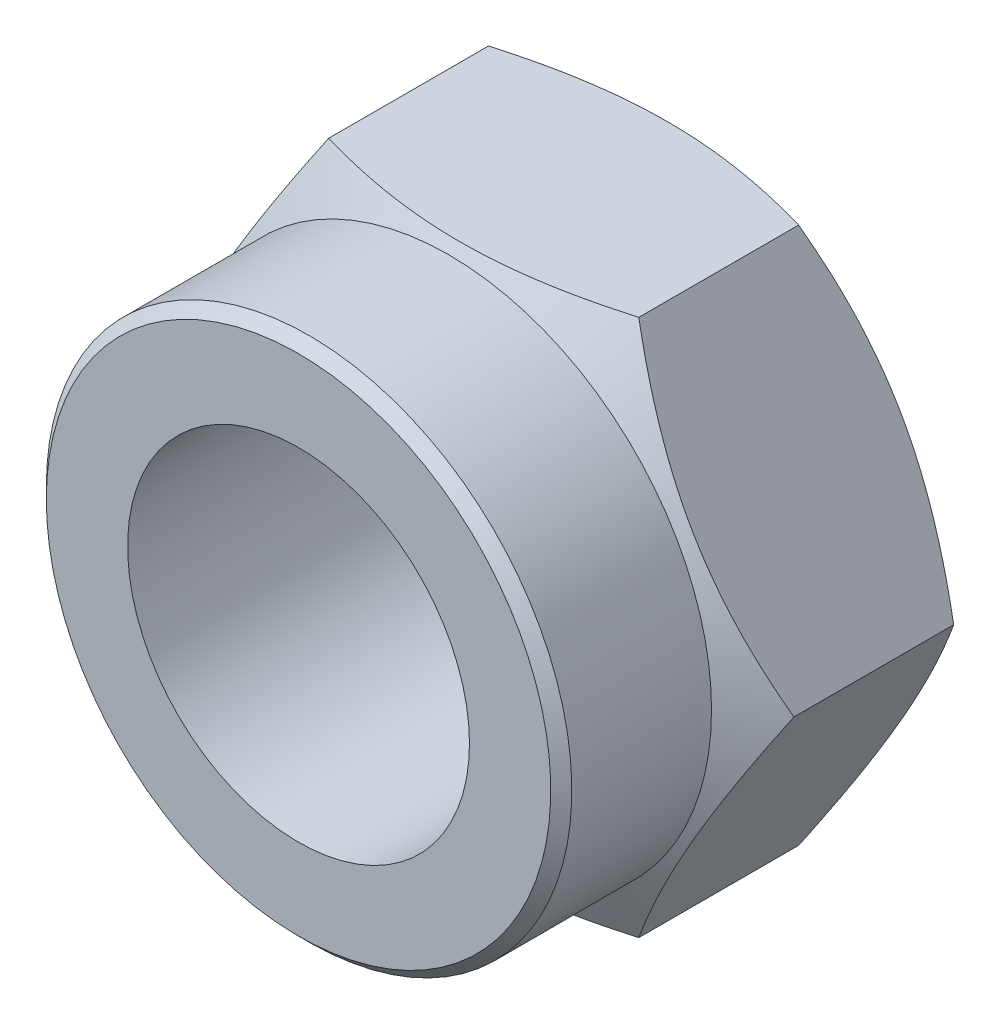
SolidWorks part; units mm, degrees
ref_plane "Front" through (0, 0, 0) normal (0, 0, 1) x (1, 0, 0)
ref_plane "Top" through (0, 0, 0) normal (0, 1, 0) x (1, 0, 0)
ref_plane "Right" through (0, 0, 0) normal (1, 0, 0) x (0, 0, -1)
sketch "Sketch1" plane through (0, 0, 0) normal (0, 0, 1) x (1, 0, 0)
  line L1 (15.8771, -27.5) -> (31.7543, 0)
  line L2 (31.7543, 0) -> (15.8771, 27.5)
  line L3 (15.8771, 27.5) -> (-15.8771, 27.5)
  line L4 (-15.8771, 27.5) -> (-31.7543, 0)
  line L5 (-31.7543, 0) -> (-15.8771, -27.5)
  line L6 (-15.8771, -27.5) -> (15.8771, -27.5)
  circle A0 centre (0, 0) radius 27.5 construction
  circle A1 centre (0, 0) radius 17.5
  dimension "xd" = 35
  dimension "s" = 55
extrude "BaseNut" add sketch "Sketch1" against normal blind 23.52
sketch "Sketch3" plane through (0, 0, 0) normal (0, 1, 0) x (1, 0, 0)
  line L0 (0, 16.3108) -> (0, -16.1137) construction
  line L2 (-2.0696, 11.76) -> (33.5085, 11.76) construction
  line L3 (25.555, 23.52) -> (31.7543, 23.52)
  line L5 (31.7543, 23.52) -> (31.7543, 19.9409)
  line L7 (31.7543, 19.9409) -> (25.555, 23.52)
  line L8 (31.7543, 3.5791) -> (25.555, 0)
  line L9 (31.7543, 0) -> (31.7543, 3.5791)
  line L10 (25.555, 0) -> (31.7543, 0)
  dimension "D1" = 30
  dimension "dw" = 51.11
revolve "Double-Chamfer" cut sketch "Sketch3" angle 360 about L0
sketch "Sketch2" plane through (20.0871, -4.2815, 0) normal (0, 0, 1) x (1, 0, 0)
  circle A1 centre (-20.0871, 4.2815) radius 17.5 construction
  circle A2 centre (-20.0871, 4.2815) radius 26.9
  circle A3 centre (-20.0871, 4.2815) radius 17.5
  dimension "s1" = 53.8
extrude "Extrude1" add sketch "Sketch2" along normal offset from surface (15.38 mm away) 38.9
sketch "Sketch5" plane through (0, 0, 0) normal (0, 1, 0) x (1, 0, 0)
  line L0 (0, 16.8008) -> (0, -2.8116) construction
  line L2 (17.5, 23.52) -> (19.45, 23.52)
  line L5 (19.45, 23.52) -> (17.5, 21.57)
  line L7 (17.5, 21.57) -> (17.5, 23.52)
  dimension "D1" = 45
  dimension "da" = 38.9
revolve "EndChamfer" cut sketch "Sketch5" angle 360 about L0
chamfer "Chamfer1" distance 1.076 angle 45 1 edges at (26.9, 0, 15.38)
sketch "Sketch6" plane through (0, 0, 0) normal (0, 1, 0) x (1, 0, 0)
  line L0 (0, 30.0005) -> (0, -32.7386) construction
  line L1 (16, 22.32) -> (17.5, 22.32)
  line L2 (17.5, 22.32) -> (18.799, 21.57)
  line L3 (18.799, 21.57) -> (17.5, 20.82)
  line L4 (17.5, 20.82) -> (16, 20.82)
  line L5 (16, 20.82) -> (16, 22.32)
  line L6 (-17.5, 21.57) -> (17.5, 21.57) construction
  dimension "D1" = 1.5
  dimension "D2" = 35
revolve "Cut-Revolve10" [suppressed] cut sketch "Sketch6" angle 360 about L0
pattern_linear "LPattern10" [suppressed] count 13 spacing 1.8 along (0, 0, 1)
equation "\"D1@Chamfer1\" = \"s1@Sketch2\" / 50"
equation "\"D2@Sketch6\" = \"xd@Sketch1\""
equation "\"D1@Sketch6\" = (  \"D2@ThreadCosmetic1\" - \"xd@Sketch1\" )  / 2"
equation "\"D3@LPattern10\" = \"D1@Sketch6\" * 1.2"
equation "\"D1@LPattern10\" = \"m1@BaseNut\" / \"D3@LPattern10\""
